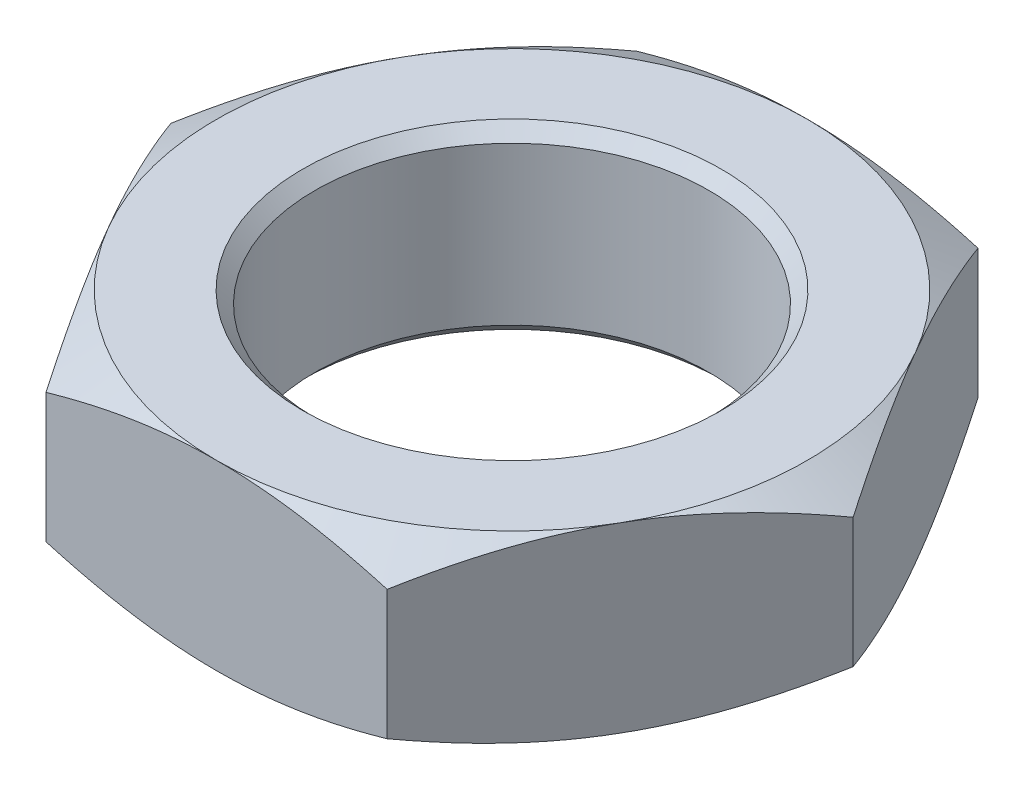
SolidWorks part; units mm, degrees
ref_plane "Front Plane" through (0, 0, 0) normal (0, 0, 1) x (1, 0, 0)
ref_plane "Top Plane" through (0, 0, 0) normal (0, 1, 0) x (1, 0, 0)
ref_plane "Right Plane" through (0, 0, 0) normal (1, 0, 0) x (0, 0, -1)
sketch "Sketch1" plane through (0, 0, 0) normal (0, 1, 0) x (1, 0, 0)
  line L1 (6.9282, 12) -> (-6.9282, 12)
  line L2 (-6.9282, 12) -> (-13.8564, 0)
  line L3 (-13.8564, 0) -> (-6.9282, -12)
  line L4 (-6.9282, -12) -> (6.9282, -12)
  line L5 (6.9282, -12) -> (13.8564, 0)
  line L6 (13.8564, 0) -> (6.9282, 12)
  circle A0 centre (0, 0) radius 12 construction
  circle A1 centre (0, 0) radius 8
  dimension "D1" = 16
  dimension "D2" = 24
extrude "Boss-Extrude1" add sketch "Sketch1" along normal mid plane 7.4
sketch "Sketch2" plane through (0, 0, 0) normal (1, 0, 0) x (0, 0, -1)
  line L0 (12, 3.7) -> (22.3923, 3.7)
  line L1 (22.3923, 3.7) -> (22.3923, -2.3)
  line L2 (22.3923, -2.3) -> (12, 3.7)
  line L3 (12, 3.7) -> (0, 3.7) construction
  line L4 (-12, -3.7) -> (-22.3923, -3.7)
  line L5 (-22.3923, -3.7) -> (-22.3923, 2.3)
  line L6 (-22.3923, 2.3) -> (-12, -3.7)
  dimension "D1" = 30
revolve "Cut-Revolve1" cut sketch "Sketch2" angle 360 about axis through (0, 3.7, 0) along (0, -1, 0)
chamfer "Chamfer1" distance 0.5 angle 45 2 edges at (0, -3.7, 8) (0, 3.7, 8)
